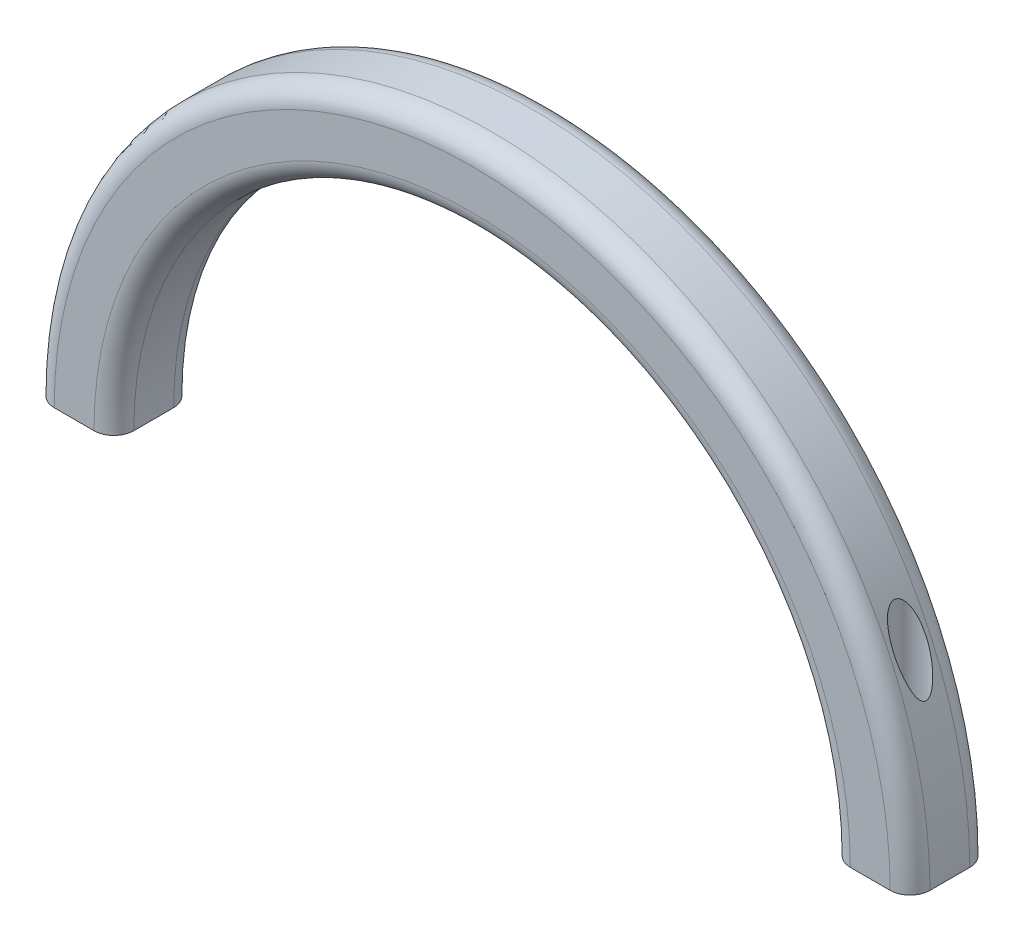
SolidWorks part; units mm, degrees
ref_plane "Front Plane" through (0, 0, 0) normal (0, 0, 1) x (1, 0, 0)
ref_plane "Top Plane" through (0, 0, 0) normal (0, 1, 0) x (1, 0, 0)
ref_plane "Right Plane" through (0, 0, 0) normal (1, 0, 0) x (0, 0, -1)
sketch "Sketch1" plane through (0, 0, 0) normal (0, 0, 1) x (1, 0, 0)
  line L0 (-69.85, 0) -> (69.85, 0)
  line L1 (0, -55) -> (0, 55) construction
  arc A2 (-69.85, 0) -> (69.85, 0) centre (0, 0) cw
  arc A3 (-57.15, 0) -> (57.15, 0) centre (0, 0) cw
  point P3 (0, 0)
  dimension "D1" = 139.7
  dimension "D2" = 127
extrude "Boss-Extrude1" add sketch "Sketch1" along normal mid plane 12.7 contours L0 A3 A2
hole_wizard "1/4-20 Tapped Hole1" positions "Sketch2" profile "Sketch3" tap size "1/4-20" standard "ANSI Inch"
sketch "Sketch2" plane through (0, 0, 0) normal (0, -1, 0) x (-1, 0, 0)
  line L0 (63.5, 0) -> (0, 0)
  line L1 (0, 0) -> (-63.5, 0)
  point P0 (63.5, 0)
  point P2 (-63.5, 0)
  dimension "D1" = 63.5
sketch "Sketch3" plane through (-63.5, 0, 0) normal (1, 0, 0) x (0, 0, -1)
  line L0 (0, 0) -> (0, 69.85)
  line L1 (0, 69.85) -> (2.5527, 69.85)
  line L2 (2.5527, 69.85) -> (2.5527, 0)
  line L5 (2.5527, 0) -> (0, 0)
  line L11 (0, -6.35) -> (0, 107.95) construction
  dimension "Thru Tap Drill Dia." = 5.1054
  dimension "Thru Tap Drill Depth" = 69.85
fillet "Fillet1" radius 3.175
